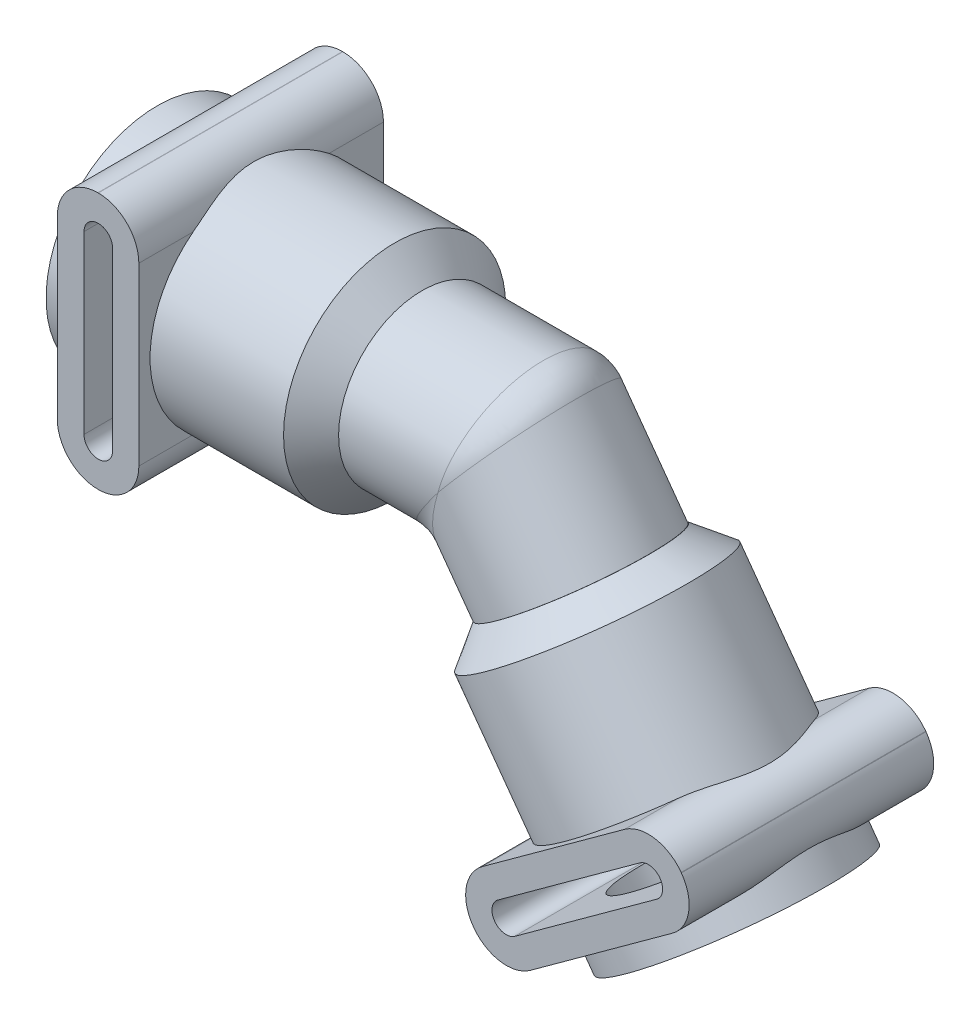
SolidWorks part; units mm, degrees
ref_plane "Plan de face" through (0, 0, 0) normal (0, 0, 1) x (1, 0, 0)
ref_plane "Plan de dessus" through (0, 0, 0) normal (0, 1, 0) x (1, 0, 0)
ref_plane "Plan de droite" through (0, 0, 0) normal (1, 0, 0) x (0, 0, -1)
sketch "Esquisse2" plane through (0, 0, 0) normal (0, 0, 1) x (1, 0, 0)
  line L0 (-5.07, 17.45) -> (1.93, 17.45)
  line L1 (-5.07, 17.45) -> (-6.42, 18.8)
  line L2 (-6.42, 18.8) -> (-18.07, 18.8)
  line L3 (-18.07, 18.8) -> (-18.07, 16.85)
  line L4 (-18.07, 16.85) -> (-12.07, 16.85)
  line L5 (-12.07, 13.35) -> (1.93, 13.35)
  line L6 (-12.07, 13.35) -> (-19.9075, 13.35) construction
  line L8 (-12.07, 16.85) -> (-12.07, 13.35)
  line L10 (1.93, 13.35) -> (1.93, 17.45)
  dimension "D1" = 7
  dimension "D2" = 10.9
  dimension "D3" = 13
  dimension "D4" = 4.1
  dimension "D5" = 135
  dimension "D6" = 14
  dimension "D7" = 20
  dimension "D8" = 13.35
  dimension "D9" = 1.93
revolve "Révolution1" add sketch "Esquisse2" angle 360 about L6
sketch "Esquisse3" plane through (0, 0, 0) normal (0, 0, 1) x (1, 0, 0)
  line L1 (-14.98, 19.65) -> (-14.96, 19.65)
  line L2 (-16.97, 17.66) -> (-16.97, 9.04)
  line L3 (-14.98, 7.05) -> (-14.96, 7.05)
  line L4 (-12.97, 17.66) -> (-12.97, 9.04)
  line L5 (1.93, 13.35) -> (-4.3882, 13.35) construction
  line L6 (-18.07, 18.8) -> (-18.07, 7.9) construction
  line L8 (-18.07, 7.9) -> (-6.42, 7.9) construction
  line L9 (1.93, 9.25) -> (1.93, 17.45) construction
  arc A0 (-14.96, 19.65) -> (-12.97, 17.66) centre (-14.96, 17.66) cw
  arc A1 (-14.98, 19.65) -> (-16.97, 17.66) centre (-14.98, 17.66) ccw
  arc A2 (-16.97, 9.04) -> (-14.98, 7.05) centre (-14.98, 9.04) ccw
  arc A3 (-14.96, 7.05) -> (-12.97, 9.04) centre (-14.96, 9.04) ccw
  point P11 (-16.97, 19.65)
  point P14 (-16.97, 7.05)
  dimension "D5" = 1.99
  dimension "D1" = 4
  dimension "D2" = 12.6
  dimension "D3" = 0.85
  dimension "D4" = 1.1
extrude "Extrusion1" add sketch "Esquisse3" along normal mid plane 12
sketch "Esquisse8" plane through (0, 0, 0) normal (0, 0, 1) x (1, 0, 0)
  line L0 (-18.8828, 17.195) -> (-12.07, 17.195)
  line L1 (-12.07, 17.195) -> (-12.07, 16.82)
  line L2 (-12.07, 16.82) -> (-6.92, 16.82)
  line L5 (-6.92, 16.82) -> (-6.92, 15.82)
  line L6 (-18.8828, 13.32) -> (-5.045, 13.32)
  line L7 (-18.8828, 17.195) -> (-18.8828, 13.32)
  line L13 (-6.92, 15.82) -> (-5.045, 15.82)
  line L14 (-18.07, 18.8) -> (-18.07, 7.9) construction
  line L16 (2.5906, 13.32) -> (-19.9018, 13.32) construction
  line L17 (-5.045, 15.82) -> (-5.045, 13.32)
  dimension "D3" = 11.15
  dimension "D1" = 3.875
  dimension "D2" = 6
  dimension "D4" = 3.5
  dimension "D5" = 2.5
ref_plane "Plan1" through (0, 0, 4) normal (0, 0, 1) x (1, 0, 0)
revolve "Enlèvement de matière-Révolution1" cut sketch "Esquisse8" angle 360 about L16
sketch "Esquisse9" plane through (0, 0, 6) normal (0, 0, 1) x (1, 0, 0)
  line L0 (-14.26, 17.66) -> (-14.26, 9.04)
  line L1 (-15.66, 17.66) -> (-15.66, 9.04)
  arc A0 (-14.26, 17.66) -> (-15.66, 17.66) centre (-14.96, 17.66) ccw
  arc A1 (-15.66, 9.04) -> (-14.26, 9.04) centre (-14.96, 9.04) ccw
  dimension "D1" = 1.4
  dimension "D2" = 1.4
  dimension "D3" = 1.4
  dimension "D4" = 0.7
  dimension "D5" = 0.7
  dimension "D6" = 0.7
extrude "Enlèv. mat.-Extru.1" cut sketch "Esquisse9" against normal through all
sketch "Esquisse10" plane through (0, 0, 0) normal (0, 0, 1) x (1, 0, 0)
  line L0 (1.93, 17.45) -> (-2.2481, 9.25)
  line L1 (-5.07, 9.25) -> (1.93, 9.25) construction
  line L2 (1.93, 9.25) -> (1.93, 17.45) construction
  line L3 (1.93, 17.45) -> (1.93, 9.25)
  line L4 (1.93, 9.25) -> (-2.2481, 9.25)
  dimension "D1" = 27
extrude "Enlèv. mat.-Extru.2" cut sketch "Esquisse10" against normal mid plane 22
mirror "Symétrie1" about plane through (1.93, 17.45, -11) normal (-0.891, 0.454, 0) of "Enlèv. mat.-Extru.1", "Extrusion1", "Enlèvement de matière-Révolution1", "Révolution1"
ref_plane "Plan2" through (-5.07, 0, 0) normal (1, 0, 0) x (0, 0, -1)
sketch "Esquisse14" plane through (0, 0, 0) normal (0, 0, 1) x (1, 0, 0)
  line L0 (-5.07, 17.45) -> (1.93, 17.45)
  line L1 (1.93, 17.45) -> (6.0445, 11.7869)
  line L2 (6.0445, 11.7869) -> (-0.5894, 6.967) construction
  line L3 (6.0445, 11.7869) -> (1.93, 17.45) construction
  line L4 (6.0445, 11.7869) -> (-0.5894, 6.967)
  line L6 (-0.5894, 6.967) -> (-5.07, 9.25)
  line L7 (-5.07, 9.25) -> (-5.07, 17.45)
extrude "Enlèv. mat.-Extru.3" cut sketch "Esquisse14" against normal mid plane 22
sketch "Esquisse12" plane through (0, 0, 0) normal (0, 0, 1) x (1, 0, 0)
  line L0 (-5.07, 13.35) -> (-0.1961, 13.35)
  line L5 (-5.07, 9.25) -> (-5.07, 17.45) construction
  line L7 (2.7033, 9.3593) -> (-0.1961, 13.35)
  line L8 (4.7258, 10.8288) -> (0.6807, 7.8899) construction
  line L9 (6.0445, 11.7869) -> (-0.5894, 6.967) construction
  dimension "D1" = 90
  dimension "D2" = 90
sketch "Esquisse13" plane through (-5.07, 0, 0) normal (1, 0, 0) x (0, 0, -1)
  circle A0 centre (0, 13.35) radius 2.47
  circle A1 centre (0, 13.35) radius 4.1
sweep "Balayage1" add profiles "Esquisse13" path "Esquisse12"
fillet "Congé6" radius 2 1 edges at (-1.4547, 10.88, 0)
fillet "Congé7" radius 2 1 edges at (-2.2852, 9.25, 0)
